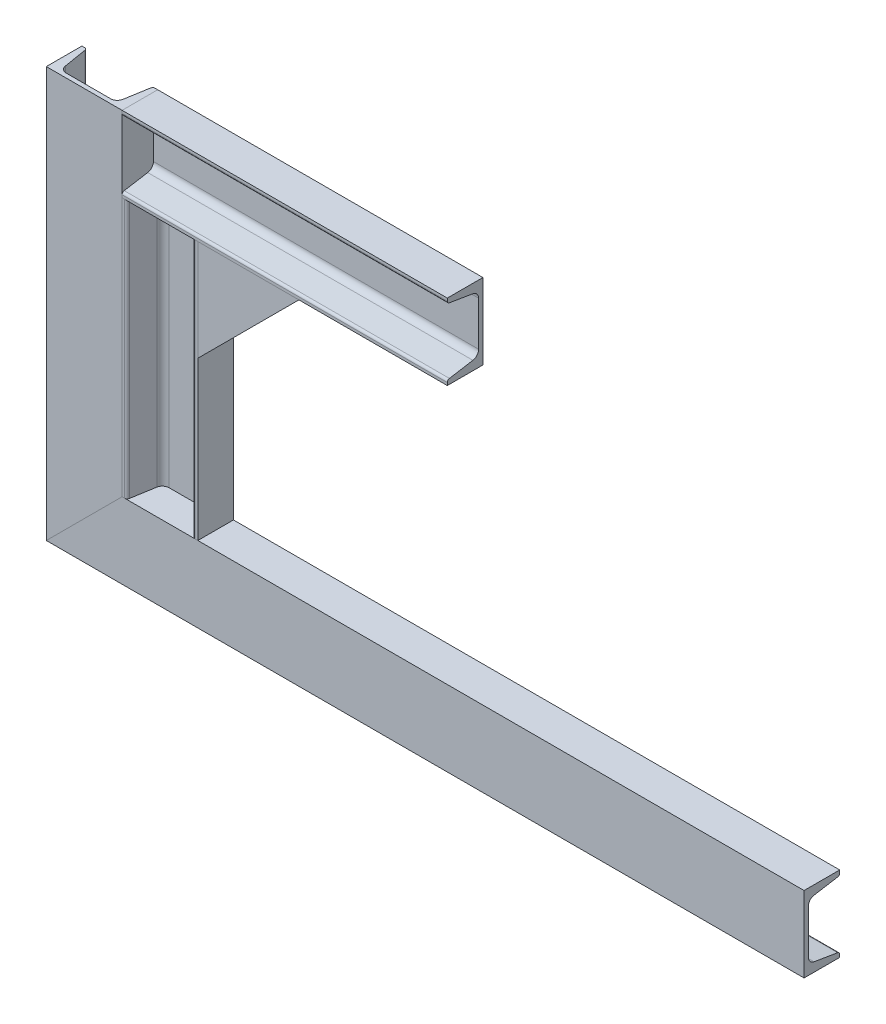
SolidWorks part; units mm, degrees
ref_plane "Front Plane" through (0, 0, 0) normal (0, 0, 1) x (1, 0, 0)
ref_plane "Top Plane" through (0, 0, 0) normal (0, 1, 0) x (1, 0, 0)
ref_plane "Right Plane" through (0, 0, 0) normal (1, 0, 0) x (0, 0, -1)
sketch "Sketch1" plane through (0, 0, 0) normal (0, 0, 1) x (1, 0, 0)
  line L0 (294.2179, 63.1259) -> (-32.8071, 63.1259)
  line L1 (-32.8071, 63.1259) -> (-32.8071, -273.4241)
  line L2 (-32.8071, -273.4241) -> (652.9929, -273.4241)
  dimension "D1" = 327.025
  dimension "D2" = 336.55
  dimension "D4" = 685.8
other "Structural Member2"
ref_plane "Plane2" through (294.2179, 63.1259, 0) normal (-1, 0, 0) x (0, -1, 0)
sketch "Sketch16" plane through (294.2179, -13.0741, 0) normal (-1, 0, 0) x (0, 0, 1)
  line L0 (0, 0) -> (0, 76.2)
  line L1 (0, 76.2) -> (35.814, 76.2)
  line L2 (0, 0) -> (35.814, 0)
  line L5 (0, 38.1) -> (4.318, 38.1) construction
  line L12 (4.318, 60.325) -> (4.318, 15.875)
  line L15 (35.814, 76.2) -> (35.814, 73.5359)
  line L16 (35.814, 0) -> (35.814, 2.6641)
  line L17 (10.0485, 67.0897) -> (33.6916, 71.0305)
  line L18 (10.0485, 9.1103) -> (33.6916, 5.1695)
  arc A9 (4.318, 15.875) -> (10.0485, 9.1103) centre (11.176, 15.875) ccw
  arc A10 (4.318, 60.325) -> (10.0485, 67.0897) centre (11.176, 60.325) cw
  arc A11 (35.814, 73.5359) -> (33.6916, 71.0305) centre (33.274, 73.5359) cw
  arc A12 (35.814, 2.6641) -> (33.6916, 5.1695) centre (33.274, 2.6641) ccw
  point P4 (17.907, 76.2)
  point P5 (17.907, 0)
  point P8 (0, 0)
  dimension "RI" = 6.858
  dimension "D2" = 9.463
  dimension "RA" = 2.54
  dimension "DEPTH" = 76.2
  dimension "BF" = 35.814
  dimension "TW" = 4.318
  dimension "d1" = 44.45
other "Structural Member4"
ref_plane "Plane6" through (-32.8071, 63.1259, 0) normal (0, -1, 0) x (1, 0, 0)
sketch "Sketch18" plane through (-109.0071, 63.1259, 35.814) normal (0, -1, 0) x (0, 0, -1)
  line L0 (0, 0) -> (0, 76.2)
  line L1 (0, 76.2) -> (35.814, 76.2)
  line L2 (0, 0) -> (35.814, 0)
  line L5 (0, 38.1) -> (4.318, 38.1) construction
  line L12 (4.318, 60.325) -> (4.318, 15.875)
  line L15 (35.814, 76.2) -> (35.814, 73.5359)
  line L16 (35.814, 0) -> (35.814, 2.6641)
  line L17 (10.0485, 67.0897) -> (33.6916, 71.0305)
  line L18 (10.0485, 9.1103) -> (33.6916, 5.1695)
  arc A9 (4.318, 15.875) -> (10.0485, 9.1103) centre (11.176, 15.875) ccw
  arc A10 (4.318, 60.325) -> (10.0485, 67.0897) centre (11.176, 60.325) cw
  arc A11 (35.814, 73.5359) -> (33.6916, 71.0305) centre (33.274, 73.5359) cw
  arc A12 (35.814, 2.6641) -> (33.6916, 5.1695) centre (33.274, 2.6641) ccw
  point P4 (17.907, 76.2)
  point P5 (17.907, 0)
  point P8 (0, 0)
  dimension "RI" = 6.858
  dimension "D2" = 9.463
  dimension "RA" = 2.54
  dimension "DEPTH" = 76.2
  dimension "BF" = 35.814
  dimension "TW" = 4.318
  dimension "d1" = 44.45
sketch "Sketch24" plane through (294.2179, 0, 0) normal (1, 0, 0) x (0, 0, -1)
  circle A0 centre (-144.6108, 25.0259) radius 114.3
  arc A1 (-35.814, 60.4618) -> (-33.6916, 57.9564) centre (-33.274, 60.4618) ccw construction
  arc A2 (-33.6916, -7.9046) -> (-35.814, -10.41) centre (-33.274, -10.41) ccw construction
extrude "Extrude8" [suppressed] cut sketch "Sketch24" against normal through all
other "Gusset3" parameters "D1"=6.35, "D2"=6.35, "D3"=0, "D4"=0, "D10"=6.35, "D11"=101.6, "D12"=101.6, "D13"=12.7, "D14"=45, "D15"=12.7
sketch "Sketch28" plane through (43.3929, -13.0741, 35.814) normal (0, 0, -1) x (-1, 0, 0)
  line L0 (0, 0) -> (0, -101.6)
  line L1 (0, 0) -> (-101.6, 0)
  line L2 (0, -101.6) -> (-101.6, 0)
other "Gusset4" parameters "D1"=6.35, "D2"=6.35, "D3"=0, "D4"=0, "D10"=6.35, "D11"=101.6, "D12"=101.6, "D13"=12.7, "D14"=45, "D15"=12.7
sketch "Sketch29" plane through (43.3929, -13.0741, 0) normal (0, 0, 1) x (1, 0, 0)
  line L0 (0, 0) -> (0, -101.6)
  line L1 (0, 0) -> (101.6, 0)
  line L2 (0, -101.6) -> (101.6, 0)
